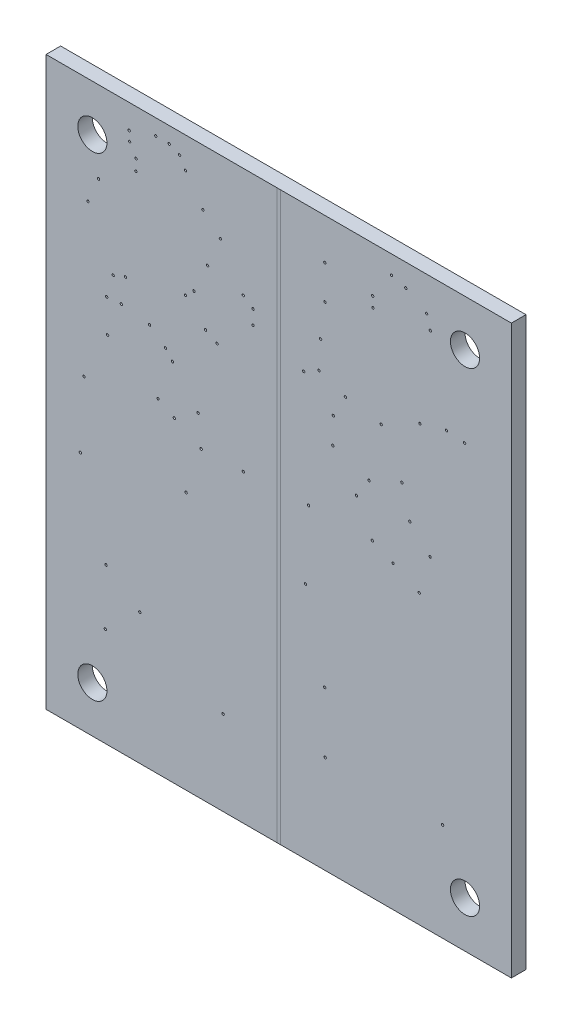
SolidWorks part; units mm, degrees
ref_plane "Front Plane" through (0, 0, 0) normal (0, 0, 1) x (1, 0, 0)
ref_plane "Top Plane" through (0, 0, 0) normal (0, 1, 0) x (1, 0, 0)
ref_plane "Right Plane" through (0, 0, 0) normal (1, 0, 0) x (0, 0, -1)
ref_plane "Dielectric_Layer Layer 1" through (0, 0, 1.6) normal (0, 0, 1) x (1, 0, 0)
sketch "Sketch1" plane through (0, 0, 0) normal (0, 0, 1) x (1, 0, 0)
  line L0 (0, 0) -> (51.054, 0)
  line L1 (51.054, 0) -> (51.054, 62.23)
  line L2 (51.054, 62.23) -> (0, 62.23)
  line L3 (0, 62.23) -> (0, 0)
extrude "Board_Outline" add sketch "Sketch1" along normal blind 1.6 separate body
sketch "Sketch2" plane through (0, 0, 0) normal (0, 0, 1) x (1, 0, 0)
  circle A0 centre (30.607, 54.0004) radius 0.127
  circle A1 centre (35.8648, 56.0832) radius 0.127
  circle A2 centre (28.4734, 26.1366) radius 0.127
  circle A3 centre (30.6324, 10.7442) radius 0.127
  circle A4 centre (43.5102, 10.7696) radius 0.127
  circle A5 centre (31.5214, 43.6626) radius 0.127
  circle A6 centre (35.433, 39.4716) radius 0.127
  circle A7 centre (36.7792, 45.466) radius 0.127
  circle A8 centre (42.1386, 35.56) radius 0.127
  circle A9 centre (4.5974, 50.5714) radius 0.127
  circle A10 centre (9.8552, 56.0578) radius 0.127
  circle A11 centre (3.7592, 26.289) radius 0.127
  circle A12 centre (6.5024, 10.8712) radius 0.127
  circle A13 centre (6.7564, 38.9382) radius 0.127
  circle A14 centre (14.0716, 34.7218) radius 0.127
  circle A15 centre (8.255, 42.6466) radius 0.127
  circle A16 centre (8.7122, 45.4406) radius 0.127
  circle A17 centre (19.1262, 54.2798) radius 0.127
  circle A18 centre (12.2936, 35.6616) radius 0.127
  circle A19 centre (15.367, 28.2956) radius 0.127
  circle A20 centre (11.3538, 42.2148) radius 0.127
  circle A21 centre (19.431, 9.271) radius 0.127
  circle A22 centre (32.8422, 46.101) radius 0.127
  circle A23 centre (34.0614, 37.338) radius 0.127
  circle A24 centre (15.2908, 58.8518) radius 0.127
  circle A25 centre (18.7706, 44.1452) radius 0.127
  circle A26 centre (14.6558, 59.9948) radius 0.127
  circle A27 centre (17.5006, 44.8056) radius 0.127
  circle A28 centre (13.5128, 60.4774) radius 0.127
  circle A29 centre (16.2306, 47.8536) radius 0.127
  circle A30 centre (12.0396, 60.5028) radius 0.127
  circle A31 centre (15.2908, 46.99) radius 0.127
  circle A32 centre (22.7076, 49.403) radius 0.127
  circle A33 centre (22.7076, 47.8536) radius 0.127
  circle A34 centre (9.1186, 59.563) radius 0.127
  circle A35 centre (13.8684, 39.9796) radius 0.127
  circle A36 centre (9.1694, 58.5216) radius 0.127
  circle A37 centre (13.1064, 40.894) radius 0.127
  circle A38 centre (17.7292, 51.0286) radius 0.127
  circle A39 centre (17.018, 33.2486) radius 0.127
  circle A40 centre (21.6408, 50.165) radius 0.127
  circle A41 centre (21.6408, 33.401) radius 0.127
  circle A42 centre (42.164, 57.0738) radius 0.127
  circle A43 centre (45.9232, 48.26) radius 0.127
  circle A44 centre (41.7576, 58.4708) radius 0.127
  circle A45 centre (43.942, 48.4632) radius 0.127
  circle A46 centre (39.4716, 59.7662) radius 0.127
  circle A47 centre (41.021, 47.6504) radius 0.127
  circle A48 centre (37.8968, 60.198) radius 0.127
  circle A49 centre (39.0398, 41.0718) radius 0.127
  circle A50 centre (30.1244, 50.2412) radius 0.127
  circle A51 centre (40.9448, 31.5468) radius 0.127
  circle A52 centre (28.2702, 46.2534) radius 0.127
  circle A53 centre (38.0746, 32.9184) radius 0.127
  circle A54 centre (29.9466, 47.1678) radius 0.127
  circle A55 centre (35.7886, 33.9344) radius 0.127
  circle A56 centre (30.5816, 57.7342) radius 0.127
  circle A57 centre (35.8394, 57.2008) radius 0.127
  circle A58 centre (28.8036, 33.782) radius 0.127
  circle A59 centre (30.5816, 17.3736) radius 0.127
  circle A60 centre (31.4706, 40.7924) radius 0.127
  circle A61 centre (39.9034, 37.7952) radius 0.127
  circle A62 centre (9.8806, 57.277) radius 0.127
  circle A63 centre (5.7658, 53.2892) radius 0.127
  circle A64 centre (4.1656, 33.7058) radius 0.127
  circle A65 centre (6.5786, 17.018) radius 0.127
  circle A66 centre (6.6548, 42.5196) radius 0.127
  circle A67 centre (16.6878, 36.4998) radius 0.127
  circle A68 centre (7.366, 44.9326) radius 0.127
  circle A69 centre (17.2085, 56.0705) radius 0.127
  circle A70 centre (10.287, 14.3764) radius 0.127
extrude "NPTH" cut sketch "Sketch2" along normal through all
sketch "Sketch3" plane through (0, 0, 0) normal (0, 0, 1) x (1, 0, 0)
  circle A0 centre (5.08, 5.08) radius 1.6
  circle A1 centre (45.97, 5.08) radius 1.6
  circle A2 centre (45.97, 57.15) radius 1.6
  circle A3 centre (5.08, 57.15) radius 1.6
extrude "PTH" cut sketch "Sketch3" along normal through all
sketch "Sketch4" plane through (0, 0, 1.6) normal (0, 0, 1) x (1, 0, 0)
  line L0 (0, 62.23) -> (0, 0) construction
  line L1 (25.7302, 62.23) -> (25.3238, 62.23)
  line L2 (25.7302, 62.23) -> (25.7302, 0)
  line L3 (25.7302, 0) -> (25.3238, 0)
  line L4 (25.3238, 62.23) -> (25.3238, 0)
  line L6 (51.054, 62.23) -> (0, 62.23) construction
  point P4 (25.527, 31.115)
  point P5 (25.3238, 31.115)
  point P6 (25.527, 62.23)
  point P7 (0, 0)
  point P10 (0, 31.115)
  point P13 (0, 0)
  point P14 (0, 0)
  point P15 (25.665, 31.115)
  point P16 (0, 0)
  dimension "D1" = 0.4064
